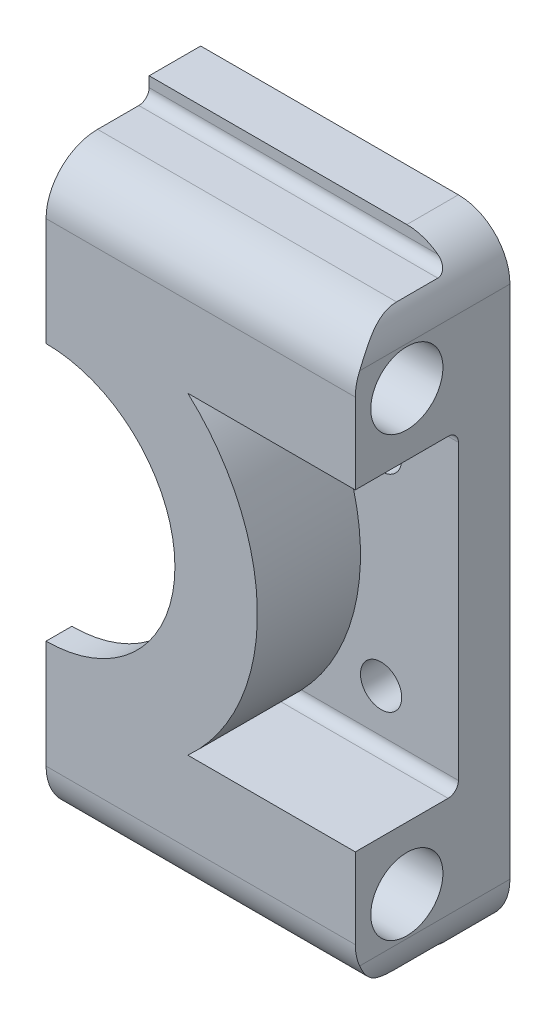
SolidWorks part; units mm, degrees
ref_plane "Front Plane" through (0, 0, 0) normal (0, 0, 1) x (1, 0, 0)
ref_plane "Top Plane" through (0, 0, 0) normal (0, 1, 0) x (1, 0, 0)
ref_plane "Right Plane" through (0, 0, 0) normal (1, 0, 0) x (0, 0, -1)
sketch "Sketch1" plane through (0, 0, -354) normal (0, 0, 1) x (1, 0, 0)
  line L1 (50, 434.7139) -> (-50, 434.7139)
  line L2 (60, 424.7139) -> (60, 324.7139)
  line L3 (50, 314.7139) -> (-50, 314.7139)
  line L4 (-60, 424.7139) -> (-60, 324.7139)
  arc A0 (50, 434.7139) -> (60, 424.7139) centre (50, 424.7139) cw
  arc A1 (50, 314.7139) -> (60, 324.7139) centre (50, 324.7139) ccw
  arc A2 (-60, 324.7139) -> (-50, 314.7139) centre (-50, 324.7139) ccw
  arc A3 (-60, 424.7139) -> (-50, 434.7139) centre (-50, 424.7139) cw
  circle A4 centre (0, 374.7139) radius 36
  circle A5 centre (45, 394.7139) radius 4
  circle A6 centre (45, 354.7139) radius 4
  dimension "D5" = 10
  dimension "D6" = 72
  dimension "D7" = 8
  dimension "D8" = 8
  dimension "D1" = 60
  dimension "D2" = 60
  dimension "D3" = 60
  dimension "D4" = 60
extrude "Boss-Extrude1" add sketch "Sketch1" along normal blind 10
sketch "Sketch2" plane through (0, 0, -344) normal (0, 0, 1) x (1, 0, 0)
  circle A0 centre (0, 374.7139) radius 36
  circle A1 centre (0, 374.7139) radius 41
  dimension "D1" = 72
  dimension "D2" = 82
extrude "Boss-Extrude2" add sketch "Sketch2" along normal blind 15
sketch "Sketch3" plane through (0, 0, -329) normal (0, 0, 1) x (1, 0, 0)
  circle A0 centre (0, 374.7139) radius 41
  circle A2 centre (0, 374.7139) radius 25
  dimension "D1" = 82
  dimension "D2" = 50
extrude "Boss-Extrude3" add sketch "Sketch3" along normal blind 5
ref_plane "Plane1" through (0, 0, 0) normal (-1, 0, 0) x (0, 0, 1)
sketch "Sketch4" plane through (0, 0, 0) normal (-1, 0, 0) x (0, 0, 1)
  line L0 (-364, 170) -> (-364, 452.7139) construction
  line L1 (-364, 443.9163) -> (-313.4267, 443.9163)
  line L2 (-364, 443.9163) -> (-364, 283.9163)
  line L3 (-364, 283.9163) -> (-313.4267, 283.9163)
  line L4 (-313.4267, 443.9163) -> (-313.4267, 283.9163)
  line L5 (-344, 462.7139) -> (372.5, 462.7139) construction
  dimension "D1" = 50.5733
  dimension "D2" = 160
  dimension "D3" = 18.7976
extrude "Cut-Extrude1" cut sketch "Sketch4" along normal through all
sketch "Sketch5" plane through (0, 0, -344) normal (0, 0, 1) x (1, 0, 0)
  line L0 (60, 405.1236) -> (27.5, 405.1236)
  line L11 (60, 324.7139) -> (60, 424.7139) construction
  line L12 (0, 430.7139) -> (58, 430.7139)
  line L13 (0, 430.7139) -> (0, 415.7139)
  line L15 (60, 424.7139) -> (60, 405.1236)
  arc A0 (0, 333.7139) -> (0, 415.7139) centre (0, 374.7139) ccw construction
  arc A1 (60, 424.7139) -> (50, 434.7139) centre (50, 424.7139) ccw construction
  arc A2 (60, 424.7139) -> (58, 430.7139) centre (50, 424.7139) ccw
  arc A3 (0, 333.7139) -> (0, 415.7139) centre (0, 374.7139) ccw construction
  arc A4 (27.5, 405.1236) -> (0, 415.7139) centre (0, 374.7139) ccw
  dimension "D2" = 32.5
extrude "Boss-Extrude4" add sketch "Sketch5" along normal blind 20
ref_plane "Plane2" through (0, 374.7139, 0) normal (0, 1, 0) x (1, 0, 0)
sketch "Sketch7" plane through (0, 0, 0) normal (-1, 0, 0) x (0, 0, 1)
  line L0 (-324, 374.7139) -> (-344, 374.7139) construction
  line L1 (-329, 374.7139) -> (-354, 374.7139) construction
  line L2 (-354, 410.7139) -> (-354, 338.7139) construction
  circle A0 centre (-337, 374.7139) radius 4
  dimension "D1" = 8
  dimension "D2" = 17
sketch "Sketch8" plane through (60, 0, 0) normal (1, 0, 0) x (0, 0, -1)
  line L0 (324, 405.1236) -> (324, 424.7139) construction
  line L1 (324, 424.7139) -> (354, 424.7139) construction
  circle A0 centre (334, 417.2139) radius 7
  dimension "D1" = 14
  dimension "D2" = 10
  dimension "D3" = 7.5
extrude "Cut-Extrude2" cut sketch "Sketch8" against normal through all
fillet "Fillet3" radius 2 2 edges at (29, 430.7139, -344) (43.75, 405.1236, -344)
mirror "Mirror4" about plane through (0, 374.7139, 0) normal (0, 1, 0) of "Boss-Extrude4", "Cut-Extrude2"
fillet "Fillet4" radius 2 2 edges at (29, 318.7139, -344) (43.75, 344.3042, -344)
sketch "Sketch9" plane through (0, 0, -344) normal (0, 0, 1) x (1, 0, 0)
  line L0 (0, 378.7139) -> (0, 370.7139) construction
  circle A0 centre (45, 394.7139) radius 4
  circle A1 centre (45, 354.7139) radius 4
  dimension "D1" = 8
  dimension "D2" = 8
  dimension "D3" = 45
  dimension "D4" = 45
  dimension "D5" = 40
  dimension "D6" = 20
fillet "Fillet5" radius 10 2 edges at (29, 318.7139, -324) (29, 430.7139, -324)
